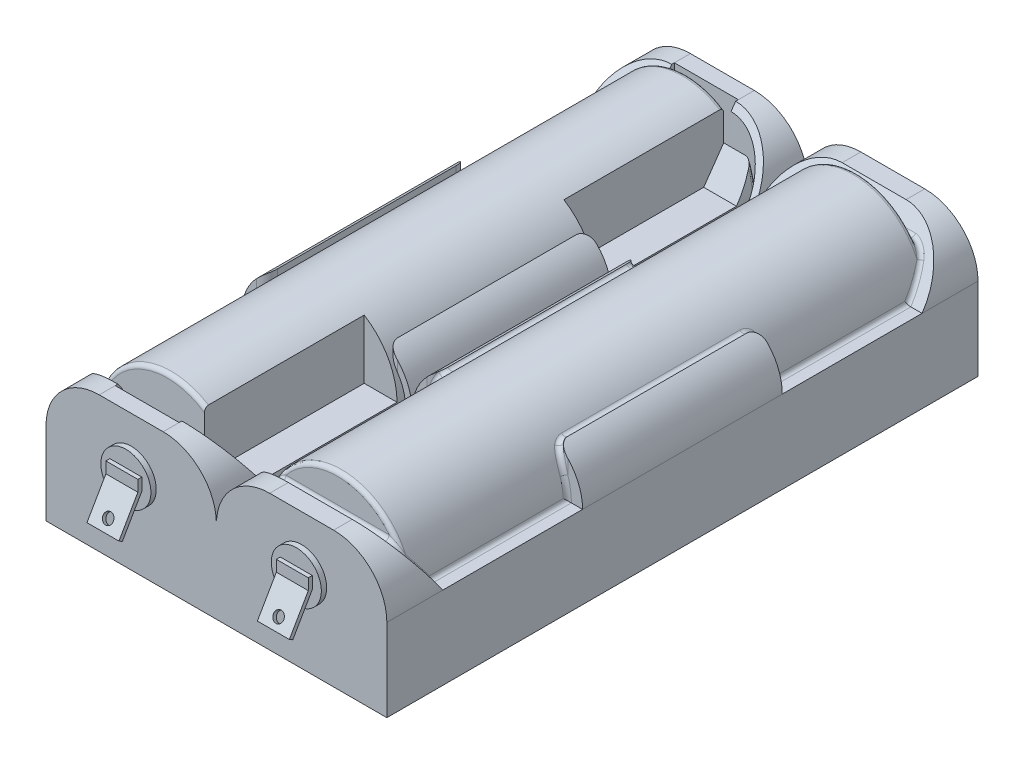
SolidWorks part; units mm, degrees
ref_plane "Plane1" through (0, 0, 0) normal (0, 0, 1) x (1, 0, 0)
ref_plane "Plane2" through (0, 0, 0) normal (0, 1, 0) x (1, 0, 0)
ref_plane "Plane3" through (0, 0, 0) normal (1, 0, 0) x (0, 0, -1)
sketch "Sketch1" plane through (0, 0, 0) normal (0, 0, 1) x (1, 0, 0)
  line L0 (-8.128, 0) -> (8.128, 0)
  line L1 (8.128, 0) -> (8.128, 7.874)
  line L2 (-8.128, 0) -> (-8.128, 7.874)
  line L3 (-3.048, 12.954) -> (3.048, 12.954)
  arc A0 (-3.048, 12.954) -> (-8.128, 7.874) centre (-3.048, 7.874) ccw
  arc A1 (8.128, 7.874) -> (3.048, 12.954) centre (3.048, 7.874) ccw
  dimension "D3" = 5.08
  dimension "D1" = 12.954
  dimension "D2" = 16.256
extrude "Base-Extrude" add sketch "Sketch1" along normal mid plane 56.388
shell "Shell1" thickness 0.635
sketch "Sketch3" plane through (0, 0, 0) normal (1, 0, 0) x (0, 0, -1)
  line L0 (-27.2461, 14.138) -> (-22.86, 7.874)
  line L1 (-28.194, 7.874) -> (28.194, 7.874) construction
  line L2 (-22.86, 7.874) -> (-9.525, 7.874)
  line L3 (-9.525, 7.874) -> (-9.525, 14.138)
  line L4 (-27.2461, 14.138) -> (-9.525, 14.138)
  line L7 (0, 0) -> (0, 24.8442) construction
  line L8 (27.2461, 14.138) -> (9.525, 14.138)
  line L9 (9.525, 7.874) -> (9.525, 14.138)
  line L10 (22.86, 7.874) -> (9.525, 7.874)
  line L11 (27.2461, 14.138) -> (22.86, 7.874)
  dimension "D1" = 9.525
  dimension "D2" = 22.86
  dimension "D3" = 125
extrude "Cut-Extrude1" cut sketch "Sketch3" against normal mid plane 25.4
sketch "Sketch4" plane through (0, 12.954, 0) normal (0, 1, 0) x (-1, 0, 0)
  line L0 (0, 11.857) -> (0, -11.857) construction
  line L1 (-5.715, -11.857) -> (5.715, -11.857)
  line L2 (-5.715, -11.857) -> (-5.715, 11.857)
  line L3 (-5.715, 11.857) -> (5.715, 11.857)
  line L4 (5.715, -11.857) -> (5.715, 11.857)
  dimension "D1" = 11.43
extrude "Cut-Extrude2" cut sketch "Sketch4" against normal blind 6.35
sketch "Sketch8" plane through (0, 1.524, 0) normal (0, 1, 0) x (-1, 0, 0)
  circle A0 centre (5.08, 22.5425) radius 1.3335
  circle A1 centre (-5.08, -22.5425) radius 1.3335
  dimension "D1" = 45.085
  dimension "D2" = 10.16
  dimension "D5" = 2.667
  dimension "D3" = 5.08
  dimension "D4" = 22.5425
extrude "Cut-Extrude3" cut sketch "Sketch8" against normal blind 6.35
fillet "Fillet1" radius 1.016 4 edges at (-5.715, 11.8138, -9.525) (5.715, 11.8138, -9.525) (5.715, 11.8138, 9.525) (-5.715, 11.8138, 9.525)
sketch "Sketch7" plane through (0, 0, 0) normal (0, 0, 1) x (1, 0, 0)
  line L0 (0, 0) -> (0, 16.319) construction
  circle A0 centre (0, 7.8519) radius 6.6862
extrude "Boss-Extrude1" add sketch "Sketch7" along normal mid plane 49.53
fillet "Fillet4" radius 0.381 6 edges at (0, 1.524, -24.765) (-2.1591, 1.524, 0) (2.1591, 1.524, 0) (0, 1.524, 24.765) (0, 14.5381, -24.765) (0, 14.5381, 24.765)
sketch "Sketch9" plane through (0, 0, 28.194) normal (0, 0, 1) x (1, 0, 0)
  circle A0 centre (0, 7.8519) radius 2.3876
  dimension "D1" = 4.7752
extrude "Boss-Extrude2" add sketch "Sketch9" along normal blind 0.508
sketch "Sketch11" plane through (0, 0, 0) normal (1, 0, 0) x (0, 0, -1)
  line L0 (-28.702, 8.702) -> (-28.702, 7.5364)
  line L1 (-28.702, 10.2395) -> (-28.702, 5.4643) construction
  line L2 (-28.702, 7.5364) -> (-30.5609, 4.3167)
  line L3 (-30.5609, 4.3167) -> (-30.8908, 4.5072)
  line L4 (-30.8908, 4.5072) -> (-29.083, 7.6385)
  line L5 (-29.083, 7.6385) -> (-29.083, 8.702)
  line L6 (-29.083, 8.702) -> (-28.702, 8.702)
  dimension "D1" = 30
  dimension "D2" = 0.381
  dimension "D3" = 0.381
  dimension "D4" = 3.7178
extrude "Boss-Extrude3" add sketch "Sketch11" along normal mid plane 3.048
sketch "Sketch12" plane through (0, 14.5029, 25.1198) normal (0, 0.5, 0.866) x (1, 0, 0)
  line L0 (0, -11.542) -> (0, -8.8286) construction
  line L1 (1.524, -11.542) -> (-1.524, -11.542) construction
  circle A0 centre (0, -10.5427) radius 0.4932
extrude "Cut-Extrude4" cut sketch "Sketch12" against normal blind 0.508
mirror "Mirror1" about plane through (0, 0, 0) normal (0, 0, 1) of "Boss-Extrude2", "Cut-Extrude4", "Boss-Extrude3"
mirror "Mirror2" of "Base-Extrude", "Cut-Extrude1", "Cut-Extrude3", "Fillet1", "Boss-Extrude1", "Fillet4", "Boss-Extrude2", "Boss-Extrude3", "Cut-Extrude4", "Mirror1"
